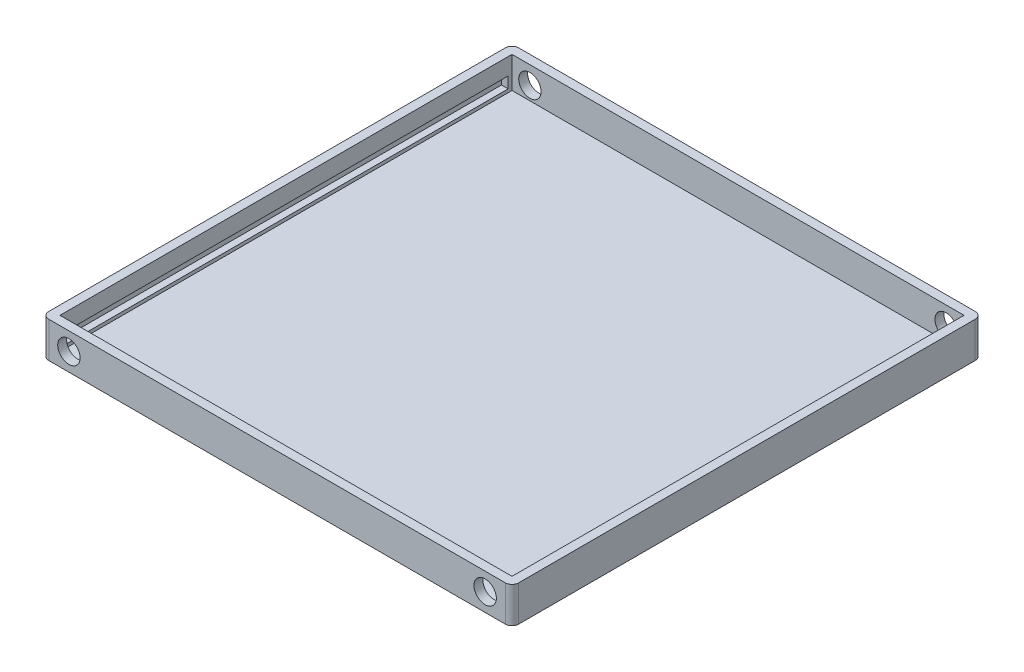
SolidWorks part; units mm, degrees
ref_plane "Front Plane" through (0, 0, 0) normal (0, 0, 1) x (1, 0, 0)
ref_plane "Top Plane" through (0, 0, 0) normal (0, 1, 0) x (1, 0, 0)
ref_plane "Right Plane" through (0, 0, 0) normal (1, 0, 0) x (0, 0, -1)
sketch "Sketch2" plane through (0, 0, 0) normal (0, 1, 0) x (1, 0, 0)
  line L1 (52.5, 52.5) -> (-52.5, 52.5)
  line L2 (52.5, 52.5) -> (52.5, -52.5)
  line L3 (52.5, -52.5) -> (-52.5, -52.5)
  line L4 (-52.5, 52.5) -> (-52.5, -52.5)
  line L5 (52.5, 52.5) -> (-52.5, -52.5) construction
  line L6 (52.5, -52.5) -> (-52.5, 52.5) construction
  point P0 (0, 0)
  dimension "D1" = 105
  dimension "D2" = 105
extrude "Boss-Extrude1" add sketch "Sketch2" along normal blind 8
sketch "Sketch3" plane through (0, 8, 0) normal (0, 1, 0) x (1, 0, 0)
  line L1 (50.5, 50.5) -> (-50.5, 50.5)
  line L2 (50.5, 50.5) -> (50.5, -50.5)
  line L3 (50.5, -50.5) -> (-50.5, -50.5)
  line L4 (-50.5, 50.5) -> (-50.5, -50.5)
  line L5 (50.5, 50.5) -> (-50.5, -50.5) construction
  line L6 (50.5, -50.5) -> (-50.5, 50.5) construction
  point P0 (0, 0)
  dimension "D1" = 101
  dimension "D2" = 101
extrude "Cut-Extrude1" cut sketch "Sketch3" against normal blind 7
sketch "Sketch7" plane through (-50.5, 0, 0) normal (1, 0, 0) x (0, 0, -1)
  line L1 (49.6518, 4.2493) -> (-51.3482, 4.2493)
  line L2 (49.6518, 4.2493) -> (49.6518, 1.7493)
  line L3 (49.6518, 1.7493) -> (-51.3482, 1.7493)
  line L4 (-51.3482, 4.2493) -> (-51.3482, 1.7493)
  line L5 (49.6518, 4.2493) -> (-51.3482, 1.7493) construction
  line L6 (49.6518, 1.7493) -> (-51.3482, 4.2493) construction
  point P0 (-0.8482, 2.9993)
  dimension "D1" = 2.5
  dimension "D2" = 101
extrude "Cut-Extrude4" cut sketch "Sketch7" against normal blind 1.5
fillet "Fillet2" radius 1.5 4 edges at (-52.5, 4, -52.5) (-52.5, 4, 52.5) (52.5, 4, 52.5) (52.5, 4, -52.5)
mirror "Mirror2" about plane through (0, 0, 0) normal (1, 0, 0) of "Cut-Extrude4"
sketch "Sketch8" plane through (0, 0, 52.5) normal (0, 0, 1) x (1, 0, 0)
  line L0 (-51, 8) -> (-51, 0) construction
  line L1 (51, 0) -> (51, 8) construction
  circle A0 centre (-46.5, 4) radius 2.5
  circle A1 centre (46.5, 4) radius 2.5
  dimension "D2" = 4.5
  dimension "D3" = 5
  dimension "D4" = 5
  dimension "D1" = 4.5
extrude "Cut-Extrude6" cut sketch "Sketch8" against normal blind 10
mirror "Mirror3" about plane through (0, 0, 0) normal (0, 0, 1) of "Cut-Extrude6"
